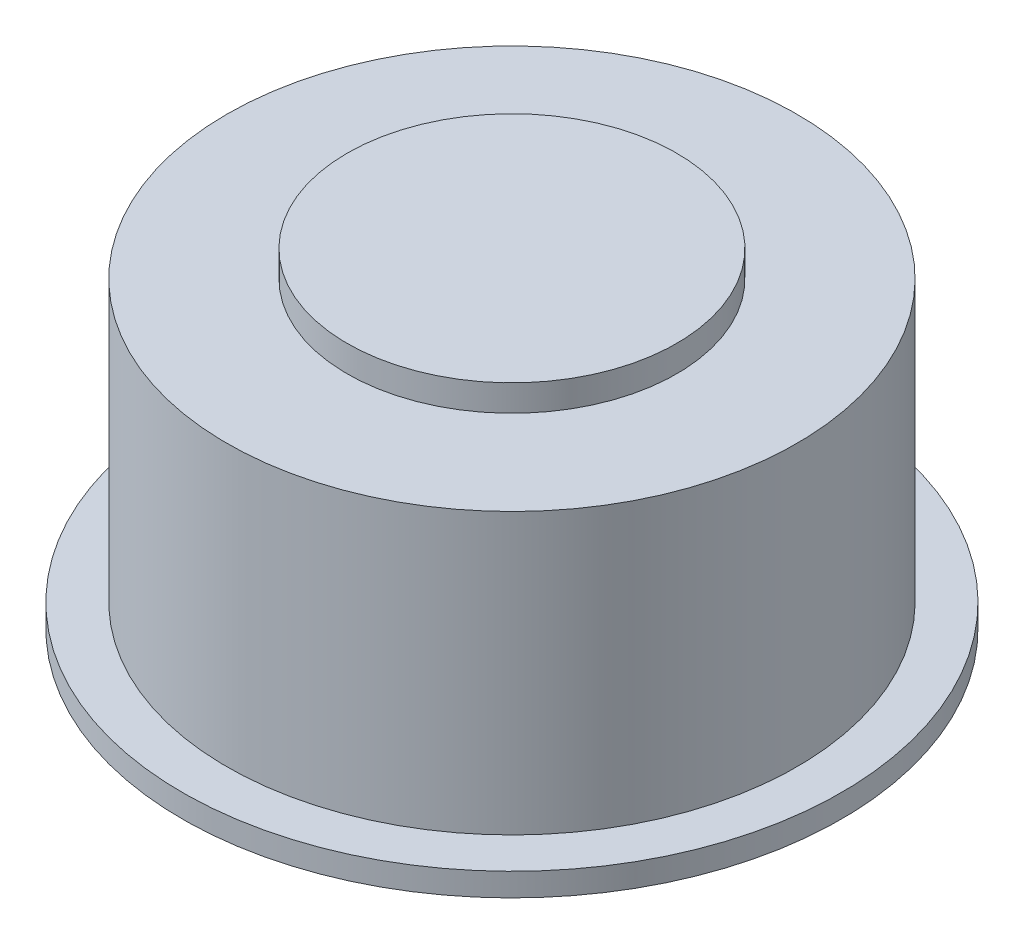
SolidWorks part; units mm, degrees
ref_plane "Front Plane" through (0, 0, 0) normal (0, 0, 1) x (1, 0, 0)
ref_plane "Top Plane" through (0, 0, 0) normal (0, 1, 0) x (1, 0, 0)
ref_plane "Right Plane" through (0, 0, 0) normal (1, 0, 0) x (0, 0, -1)
sketch "Sketch1" plane through (0, 0, 0) normal (0, 0, 1) x (1, 0, 0)
  line L0 (0, 0) -> (100, 0)
  line L1 (100, 0) -> (100, 7)
  line L2 (100, 7) -> (86.5, 7)
  line L3 (86.5, 7) -> (86.5, 92)
  line L4 (86.5, 92) -> (50, 92)
  line L5 (50, 92) -> (50, 100)
  line L6 (50, 100) -> (0, 100)
  line L7 (0, 100) -> (0, 0)
  point P9 (93.25, 7)
  dimension "D1" = 100
  dimension "D2" = 7
  dimension "D3" = 86.5
  dimension "D4" = 85
  dimension "D5" = 50
  dimension "D6" = 8
revolve "Revolve1" add sketch "Sketch1" angle 360 about L7
